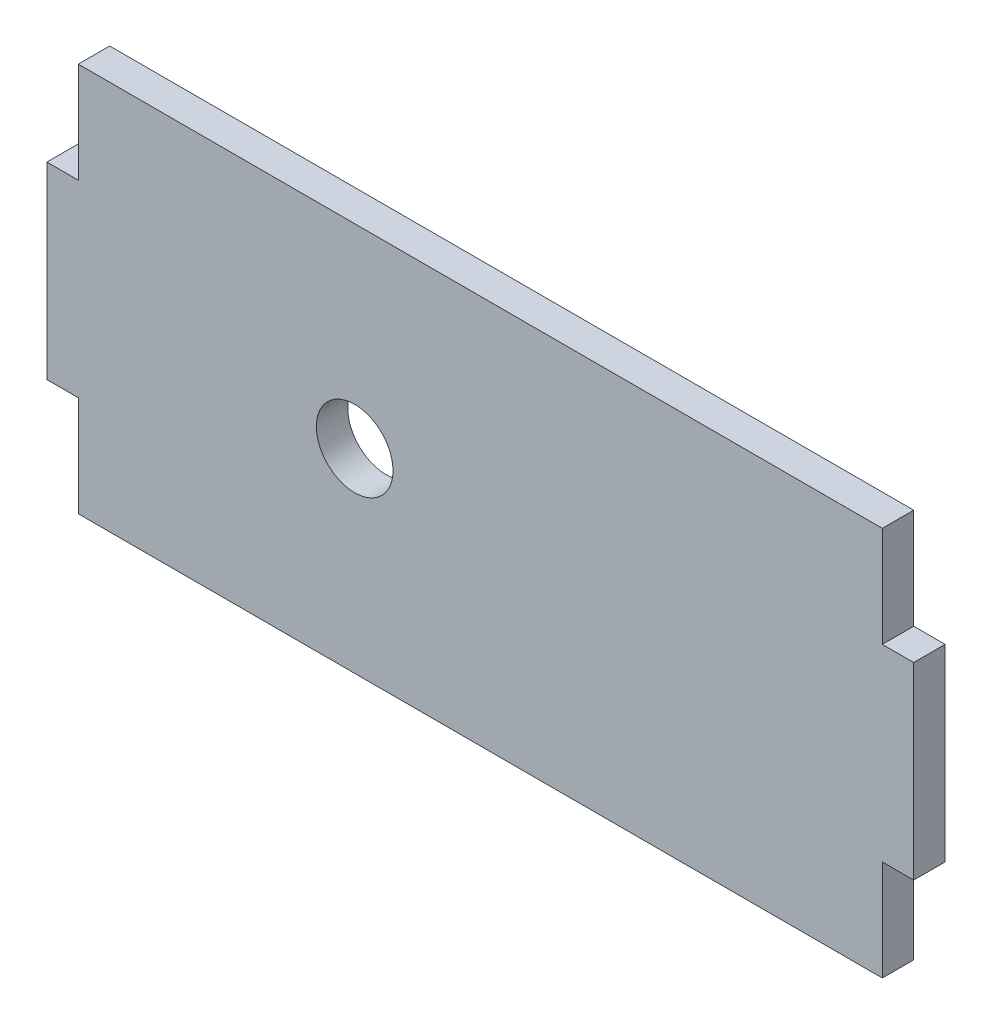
SolidWorks part; units mm, degrees
ref_plane "Front Plane" through (0, 0, 0) normal (0, 0, 1) x (1, 0, 0)
ref_plane "Top Plane" through (0, 0, 0) normal (0, 1, 0) x (1, 0, 0)
ref_plane "Right Plane" through (0, 0, 0) normal (1, 0, 0) x (0, 0, -1)
sketch "Sketch1" plane through (0, 0, 0) normal (0, 0, 1) x (1, 0, 0)
  line L1 (-2.5, 7.5) -> (0, 7.5)
  line L2 (-2.5, 7.5) -> (-2.5, -7.5)
  line L3 (-2.5, -7.5) -> (0, -7.5)
  line L5 (0, -15.5) -> (64, -15.5)
  line L6 (0, -15.5) -> (0, -7.5)
  line L7 (0, 15.5) -> (64, 15.5)
  line L9 (64, -15.5) -> (64, -7.5)
  line L11 (66.5, -7.5) -> (64, -7.5)
  line L12 (66.5, 7.5) -> (66.5, -7.5)
  line L13 (66.5, 7.5) -> (64, 7.5)
  line L14 (64, 7.5) -> (64, 15.5)
  line L15 (0, 7.5) -> (0, 15.5)
extrude "Boss-Extrude1" add sketch "Sketch1" along normal blind 2.5 contours L7 L14 L13 L12 L11 L9 L5 L6 L3 L2 L1 L15
sketch "Sketch2" plane through (0, 0, 2.5) normal (0, 0, 1) x (1, 0, 0)
  circle A0 centre (22, 0) radius 3.05
  dimension "D1" = 6.1
extrude "Cut-Extrude1" cut sketch "Sketch2" against normal blind 2.5
